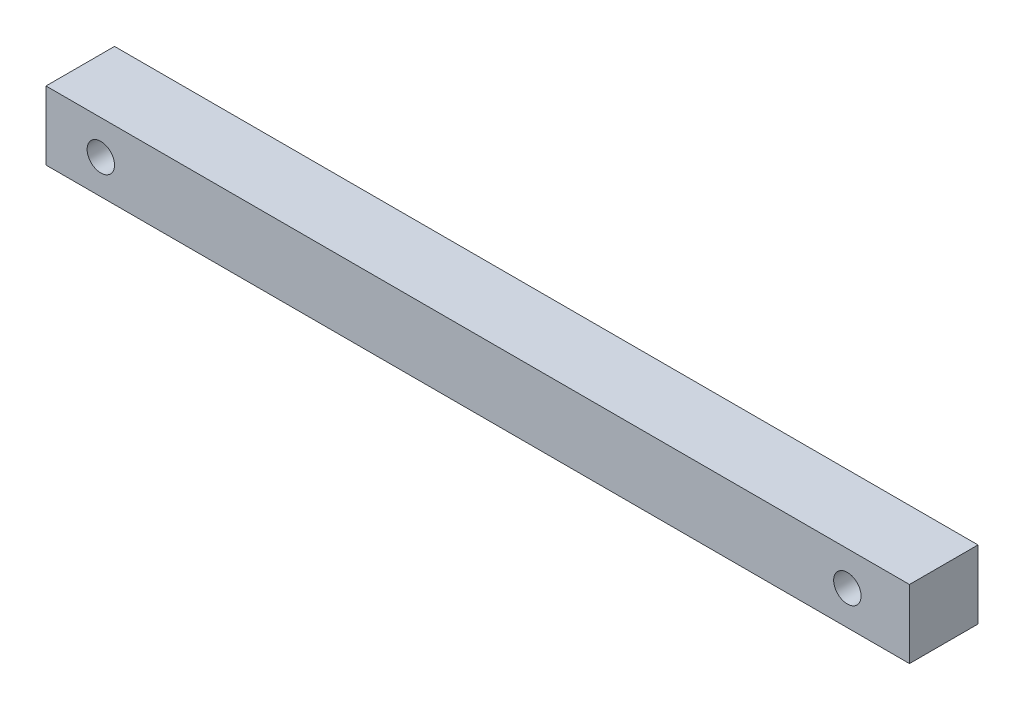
SolidWorks part; units mm, degrees
ref_plane "Front Plane" through (0, 0, 0) normal (0, 0, 1) x (1, 0, 0)
ref_plane "Top Plane" through (0, 0, 0) normal (0, 1, 0) x (1, 0, 0)
ref_plane "Right Plane" through (0, 0, 0) normal (1, 0, 0) x (0, 0, -1)
sketch "Sketch1" plane through (0, 0, 0) normal (0, 0, 1) x (1, 0, 0)
  line L1 (-33, 2.5) -> (30, 2.5)
  line L2 (-33, 2.5) -> (-33, -2.5)
  line L3 (-33, -2.5) -> (30, -2.5)
  line L4 (30, 2.5) -> (30, -2.5)
extrude "Boss-Extrude1" add sketch "Sketch1" along normal blind 5
sketch "Sketch2" plane through (0, 0, 5) normal (0, 0, 1) x (1, 0, 0)
  line L0 (-33, 2.5) -> (-33, -2.5) construction
  circle A0 centre (-29, 0) radius 1
  circle A1 centre (25.4677, 0) radius 1
  dimension "D1" = 54.4677
  dimension "D2" = 4
extrude "Cut-Extrude1" cut sketch "Sketch2" against normal blind 5
